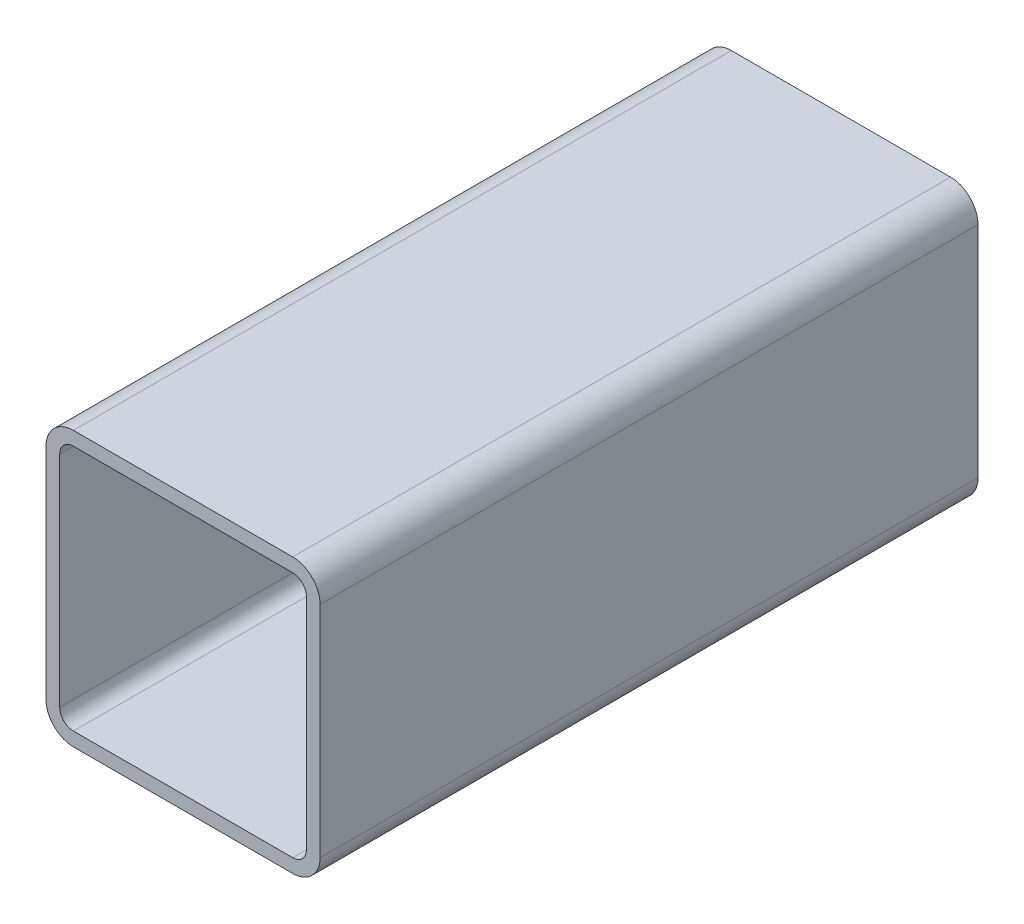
SolidWorks part; units mm, degrees
ref_plane "Front Plane" through (0, 0, 0) normal (0, 0, 1) x (1, 0, 0)
ref_plane "Top Plane" through (0, 0, 0) normal (0, 1, 0) x (1, 0, 0)
ref_plane "Right Plane" through (0, 0, 0) normal (1, 0, 0) x (0, 0, -1)
sketch "Sketch1" plane through (0, 0, 0) normal (0, 0, 1) x (1, 0, 0)
sketch_block_instance "HSS5x5x0.250-1"
sketch_block "HSS5x5x0.250"
extrude "Boss-Extrude1" add sketch "Sketch1" along normal blind 304.8
